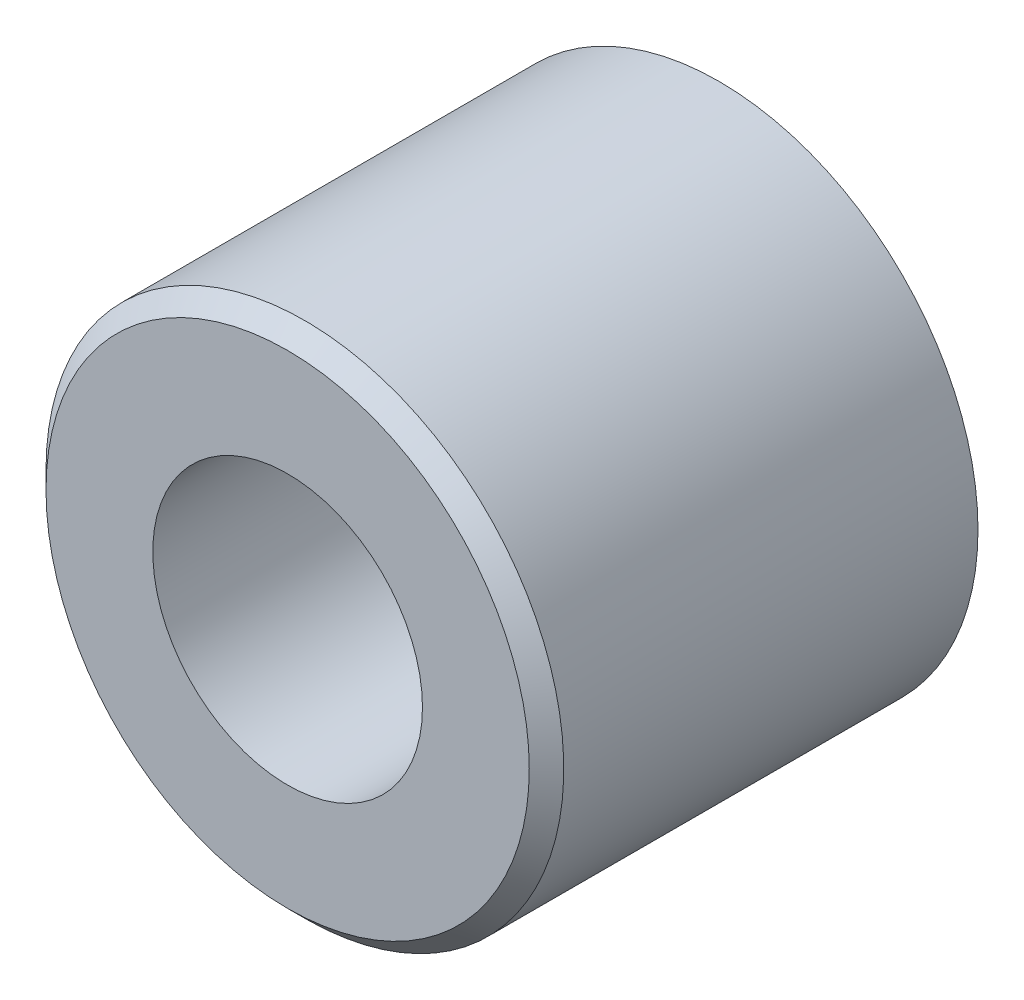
SolidWorks part; units mm, degrees
ref_plane "Alzado" through (0, 0, 0) normal (0, 0, 1) x (1, 0, 0)
ref_plane "Planta" through (0, 0, 0) normal (0, 1, 0) x (1, 0, 0)
ref_plane "Vista lateral" through (0, 0, 0) normal (1, 0, 0) x (0, 0, -1)
sketch "Croquis1" plane through (0, 0, 0) normal (0, 0, 1) x (1, 0, 0)
  circle A0 centre (0, 0) radius 3.125
  circle A1 centre (0, 0) radius 6
  dimension "D1" = 6.25
  dimension "D2" = 12
extrude "Saliente-Extruir1" add sketch "Croquis1" along normal blind 10
chamfer "Chaflán1" distance 0.4 angle 45 1 edges at (6, 0, 10)
